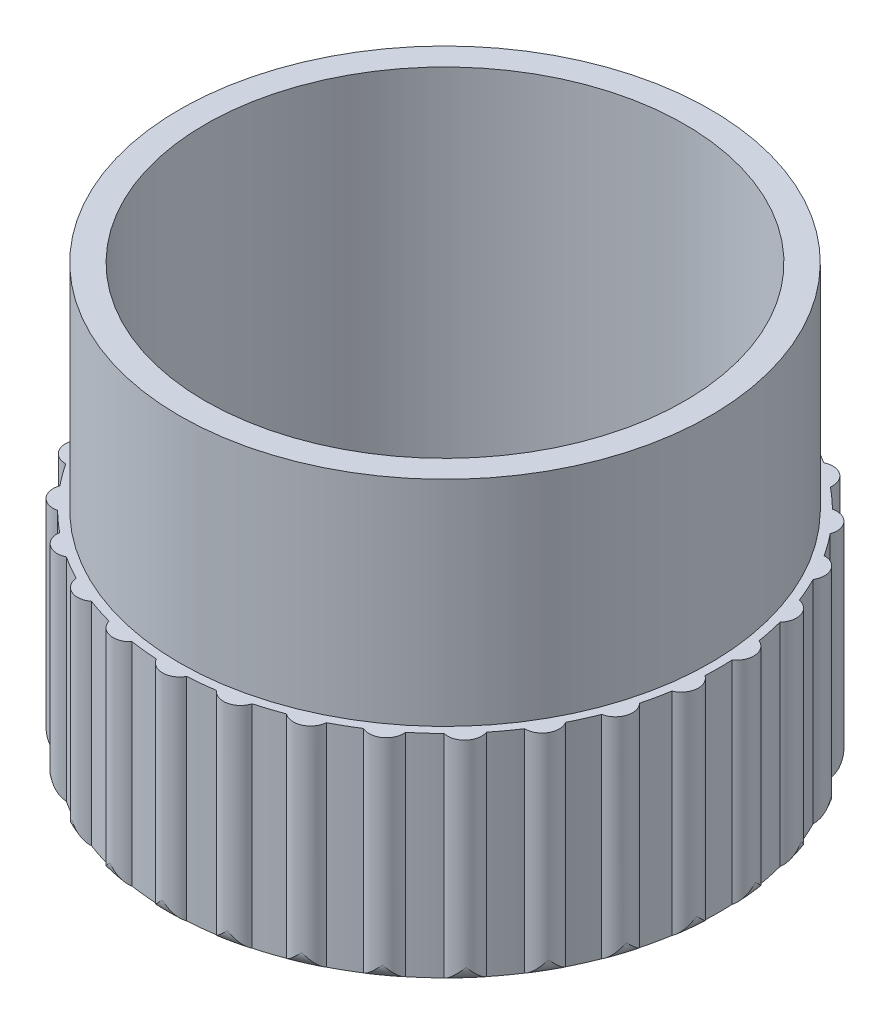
SolidWorks part; units mm, degrees
ref_plane "Plan de face" through (0, 0, 0) normal (0, 0, 1) x (1, 0, 0)
ref_plane "Plan de dessus" through (0, 0, 0) normal (0, 1, 0) x (1, 0, 0)
ref_plane "Plan de droite" through (0, 0, 0) normal (1, 0, 0) x (0, 0, -1)
sketch "Esquisse1" plane through (0, 0, 0) normal (0, 0, 1) x (1, 0, 0)
  line L0 (0, 0) -> (-32, 0)
  line L1 (55, 0) -> (-55, 0) construction
  line L2 (-32, 0) -> (-32, 25)
  line L3 (-32, 25) -> (-31, 25)
  line L4 (-31, 25) -> (-31, 50)
  line L5 (-31, 50) -> (-28, 50)
  line L6 (-28, 50) -> (-28, 3)
  line L7 (-28, 3) -> (0, 3)
  line L8 (0, -55) -> (0, 55) construction
  line L9 (0, 3) -> (0, 0)
  line L10 (28, 50) -> (28, 3) construction
  line L11 (31, 50) -> (28, 50) construction
  line L12 (31, 25) -> (31, 50) construction
  line L13 (32, 25) -> (31, 25) construction
  line L14 (32, 0) -> (32, 25) construction
  dimension "D1" = 3
  dimension "D2" = 3
  dimension "D3" = 62
  dimension "D4" = 64
  dimension "D5" = 50
  dimension "D6" = 25
revolve "Révolution1" add sketch "Esquisse1" angle 360 about L9
sketch "Esquisse2" plane through (0, 0, 0) normal (0, 1, 0) x (1, 0, 0)
  line L0 (0, -27.5) -> (0, 27.5) construction
  circle A0 centre (0, 0) radius 32 construction
  arc A1 (1.7591, -31.9516) -> (-1.7591, -31.9516) centre (0, -31) cw
  circle A2 centre (0, 0) radius 33
  circle A3 centre (0, 0) radius 33 construction
  arc A4 (-1.7591, -31.9516) -> (1.7591, -31.9516) centre (0, 0) ccw
  dimension "D2" = 2
  dimension "D1" = 1
extrude "Extrusion1" add sketch "Esquisse2" along normal up to surface (25 mm away)
pattern_circular "Répétition circulaire1" count 30 every 12 about axis through (0, 0, 0) along (0, 1, 0) of "Extrusion1", "Révolution1"
sketch "Esquisse3" plane through (0, 0, 0) normal (1, 0, 0) x (0, 0, -1)
  line L0 (36.1132, 0) -> (-36.1132, 0) construction
  line L1 (-33, 25) -> (-33, 0) construction
  line L2 (-33, 2) -> (-33, 0)
  line L3 (-33, 0) -> (-31, 0)
  line L4 (0, 0) -> (0, 25) construction
  line L5 (0, 25) -> (0, 50) construction
  line L6 (0, 0) -> (0, 25) construction
  arc A0 (-33, 2) -> (-31, 0) centre (-31, 2) ccw
  dimension "D1" = 2
revolve "Enlèvement de matière-Révolution1" cut sketch "Esquisse3" angle 360 about L4
